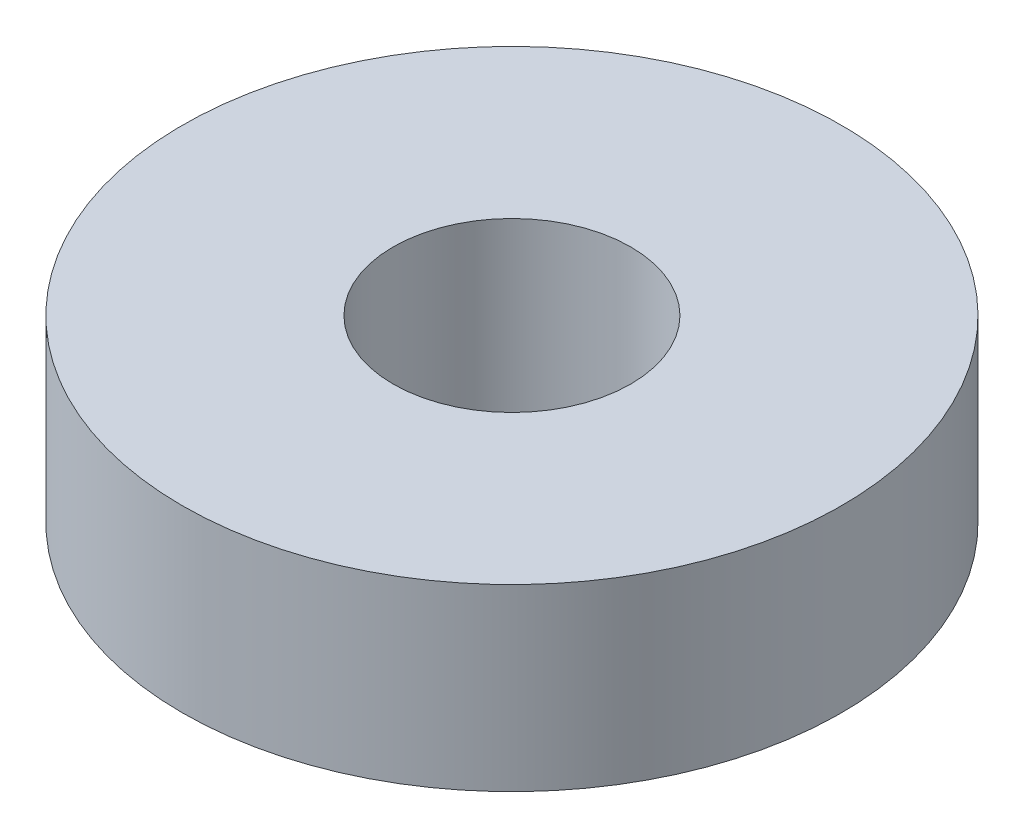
SolidWorks part; units mm, degrees
ref_plane "Front Plane" through (0, 0, 0) normal (0, 0, 1) x (1, 0, 0)
ref_plane "Top Plane" through (0, 0, 0) normal (0, 1, 0) x (1, 0, 0)
ref_plane "Right Plane" through (0, 0, 0) normal (1, 0, 0) x (0, 0, -1)
sketch "Sketch1" plane through (0, 0, 0) normal (0, 1, 0) x (1, 0, 0)
  circle A0 centre (0, 0) radius 3.3655
  circle A1 centre (0, 0) radius 9.3345
  dimension "D1" = 6.731
  dimension "D2" = 18.669
extrude "Boss-Extrude1" add sketch "Sketch1" along normal blind 5.08
